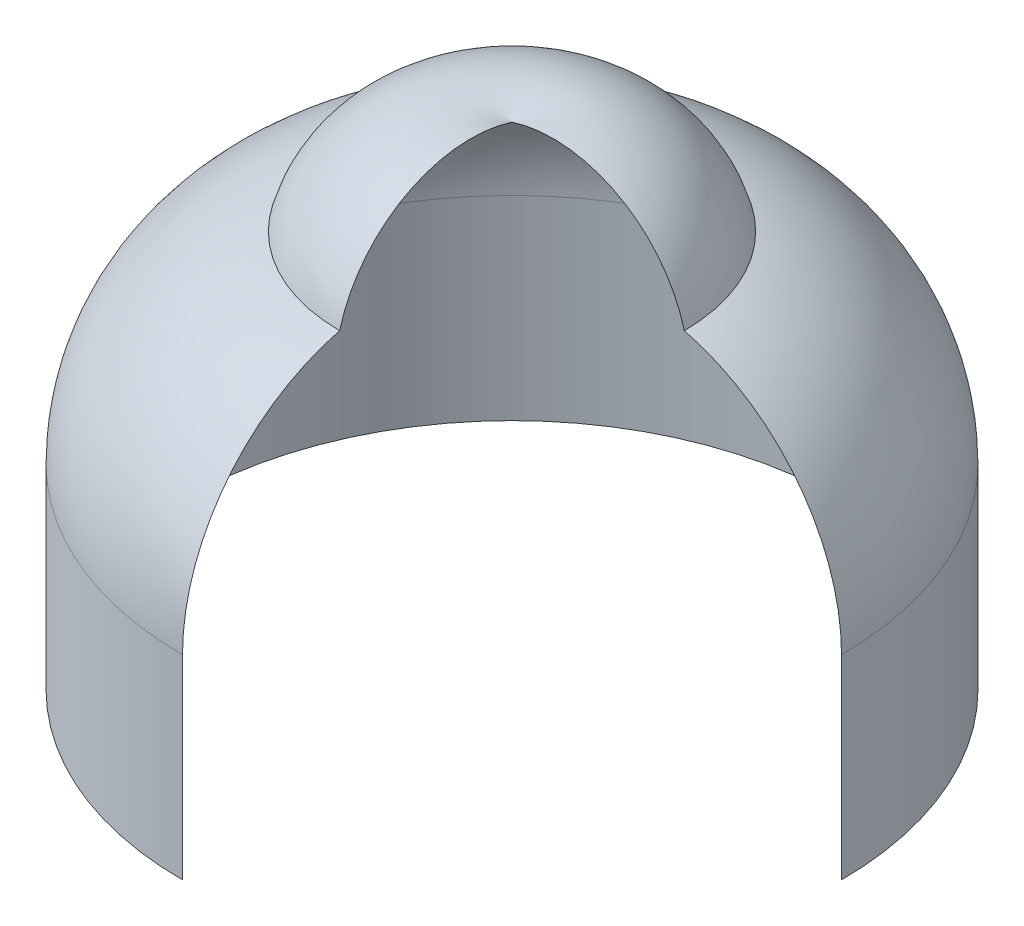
SolidWorks part; units mm, degrees
ref_plane "Front Plane" through (0, 0, 0) normal (0, 0, 1) x (1, 0, 0)
ref_plane "Top Plane" through (0, 0, 0) normal (0, 1, 0) x (1, 0, 0)
ref_plane "Right Plane" through (0, 0, 0) normal (1, 0, 0) x (0, 0, -1)
sketch "Sketch1" plane through (0, 0, 0) normal (0, 0, 1) x (1, 0, 0)
  line L0 (0, 79.0394) -> (0, -65.931) construction
  line L1 (68, 0) -> (68, -40.25)
  arc A0 (0, 61.1786) -> (35.5631, 41.6824) centre (8.5, 34.5) cw
  arc A1 (35.5631, 41.6824) -> (68, 0) centre (25, 0) cw
  dimension "D1" = 28
  dimension "D2" = 43
  dimension "D4" = 34.5
  dimension "D5" = 16.5
  dimension "D3" = 40.25
  dimension "D6" = 25
surface "Surface-Revolve1" sketch "Sketch1" parameters "D1"=270
